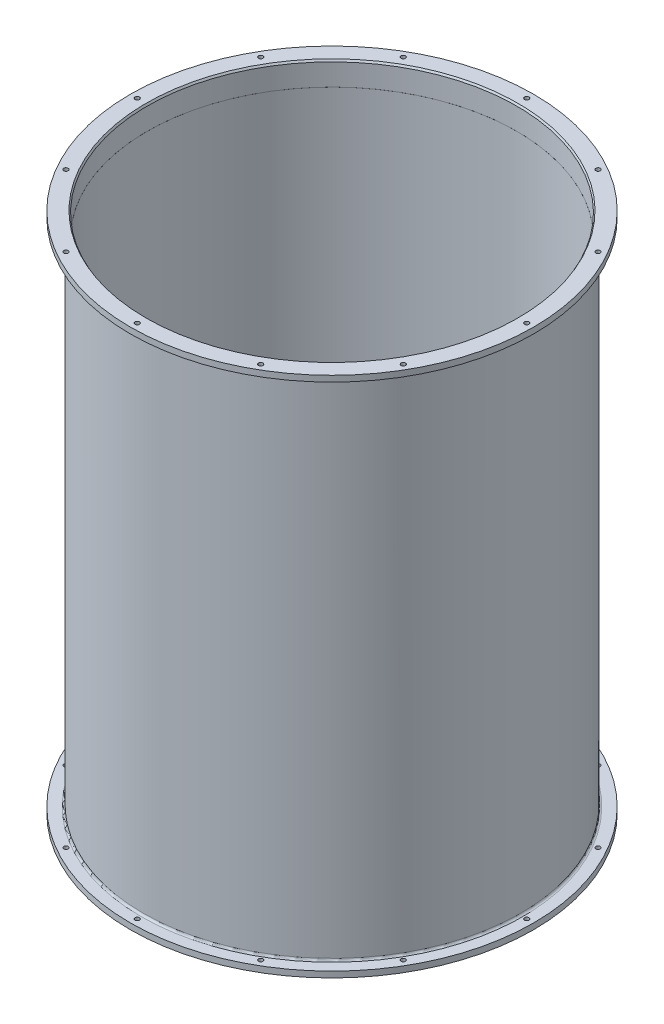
SolidWorks part; units mm, degrees
ref_plane "Front" through (0, 0, 0) normal (0, 0, 1) x (1, 0, 0)
ref_plane "Top" through (0, 0, 0) normal (0, 1, 0) x (1, 0, 0)
ref_plane "Right" through (0, 0, 0) normal (1, 0, 0) x (0, 0, -1)
sketch "Sketch1" plane through (0, 0, 0) normal (0, 0, 1) x (1, 0, 0)
  line L0 (0, 86.36) -> (0, -91.44) construction
  line L1 (-296.8625, 381) -> (-296.926, 381)
  line L2 (-323.85, 419.1) -> (-296.926, 419.1)
  line L3 (-296.8625, 381) -> (-296.8625, -381)
  line L4 (-323.85, -409.575) -> (-303.2125, -409.575)
  line L5 (-323.85, 419.1) -> (-323.85, 409.575)
  line L6 (-323.85, 409.575) -> (-303.2125, 409.575)
  line L7 (-303.2125, 409.575) -> (-303.2125, -409.575)
  line L8 (0, 0) -> (-93.98, 0) construction
  line L9 (-323.85, -419.1) -> (-323.85, -409.575)
  line L10 (-296.926, -419.1) -> (-323.85, -419.1)
  line L11 (-296.926, -381) -> (-296.8625, -381)
  line L12 (-296.926, 381) -> (-296.926, 419.1)
  line L13 (-296.926, -381) -> (-296.926, -419.1)
  point P14 (-279.4, 0)
  point P18 (-296.8625, 0)
  dimension "D1" = 593.852
  dimension "D2" = 838.2
  dimension "D3" = 606.425
  dimension "D4" = 593.725
  dimension "D5" = 38.1
  dimension "D6" = 9.525
  dimension "D7" = 647.7
revolve "Revolve1" add sketch "Sketch1" angle 360 about L0
sketch "Sketch2" plane through (0, 419.1, 0) normal (0, 1, 0) x (-1, 0, 0)
  line L0 (0, 0) -> (0, 401.32) construction
  circle A0 centre (0, 0) radius 312.7375 construction
  circle A1 centre (0, 312.7375) radius 3.556
  dimension "D1" = 625.475
  dimension "D2" = 7.112
extrude "Cut-Extrude1" cut sketch "Sketch2" against normal through all
pattern_circular "CirPattern1" count 12 over 360 about axis through (0, 0, 0) along (0, 1, 0) of "Cut-Extrude1"
mirror "Mirror1" [suppressed] about plane through (0, 0, 0) normal (0, 1, 0)
sketch "Sketch3" plane through (0, 0, 0) normal (0, 0, 1) x (1, 0, 0)
  line L0 (190.5, 533.4) -> (198.4375, 533.4)
  line L1 (198.4375, 533.4) -> (198.4375, -533.4)
  line L2 (0, 176.4524) -> (0, -152.0494) construction
  line L3 (190.5, 533.4) -> (190.5, -533.4)
  line L5 (381, 0) -> (-373.38, 0) construction
  line L6 (190.5, -533.4) -> (198.4375, -533.4)
  line L7 (0, -419.1) -> (0, -409.575) construction
  dimension "D1" = 396.875
  dimension "D2" = 1066.8
  dimension "D3" = 381
chamfer "Chamfer1" distance 3.048 angle 30 1 edges at (0, -419.1, 296.926)
fillet "Fillet1" radius 3.175 1 edges at (0, 409.575, 303.2125)
fillet "Fillet2" radius 3.175 1 edges at (0, -409.575, 303.2125)
sketch "Sketch4" plane through (0, -419.1, 0) normal (0, -1, 0) x (1, 0, 0)
  circle A0 centre (0, 0) radius 301.625
chamfer "Chamfer2" distance 3.048 angle 30 1 edges at (0, 419.1, 296.926)
